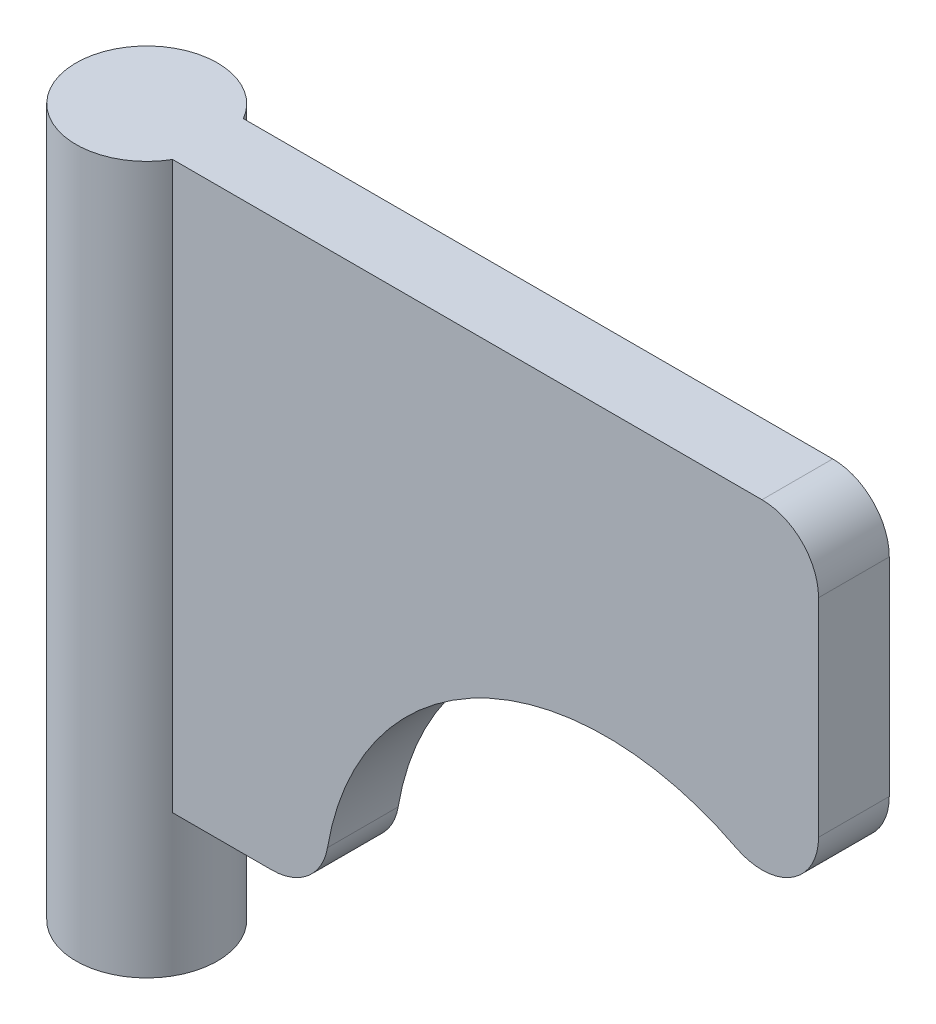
SolidWorks part; units mm, degrees
ref_plane "Front Plane" through (0, 0, 0) normal (0, 0, 1) x (1, 0, 0)
ref_plane "Top Plane" through (0, 0, 0) normal (0, 1, 0) x (1, 0, 0)
ref_plane "Right Plane" through (0, 0, 0) normal (1, 0, 0) x (0, 0, -1)
sketch "Sketch1" plane through (0, 0, 0) normal (0, 0, 1) x (1, 0, 0)
  line L1 (0, 0) -> (7.1982, 0)
  line L2 (0, 0) -> (0, 25.4)
  line L3 (0, 25.4) -> (29.21, 25.4)
  line L4 (31.75, 13.545) -> (31.75, 22.86)
  arc A0 (28.0458, 11.2875) -> (9.7026, 2.1167) centre (22.225, 0) ccw
  arc A1 (9.7026, 2.1167) -> (7.1982, 0) centre (7.1982, 2.54) cw
  arc A2 (29.21, 25.4) -> (31.75, 22.86) centre (29.21, 22.86) cw
  arc A4 (28.0458, 11.2875) -> (31.75, 13.545) centre (29.21, 13.545) ccw
  point P11 (31.75, 25.4)
  point P14 (0, 25.4)
  dimension "D3" = 12.7
  dimension "D5" = 2.54
  dimension "D1" = 25.4
  dimension "D2" = 31.75
  dimension "D4" = 9.525
extrude "Boss-Extrude1" add sketch "Sketch1" along normal blind 3.175
sketch "Sketch2" plane through (0, 0, 0) normal (0, -1, 0) x (1, 0, 0)
  line L0 (0, 3.175) -> (0, 0) construction
  circle A0 centre (0, 1.5875) radius 3.175
  dimension "D1" = 6.35
extrude "Boss-Extrude2" add sketch "Sketch2" along normal blind 6.35 and the other way up to surface
